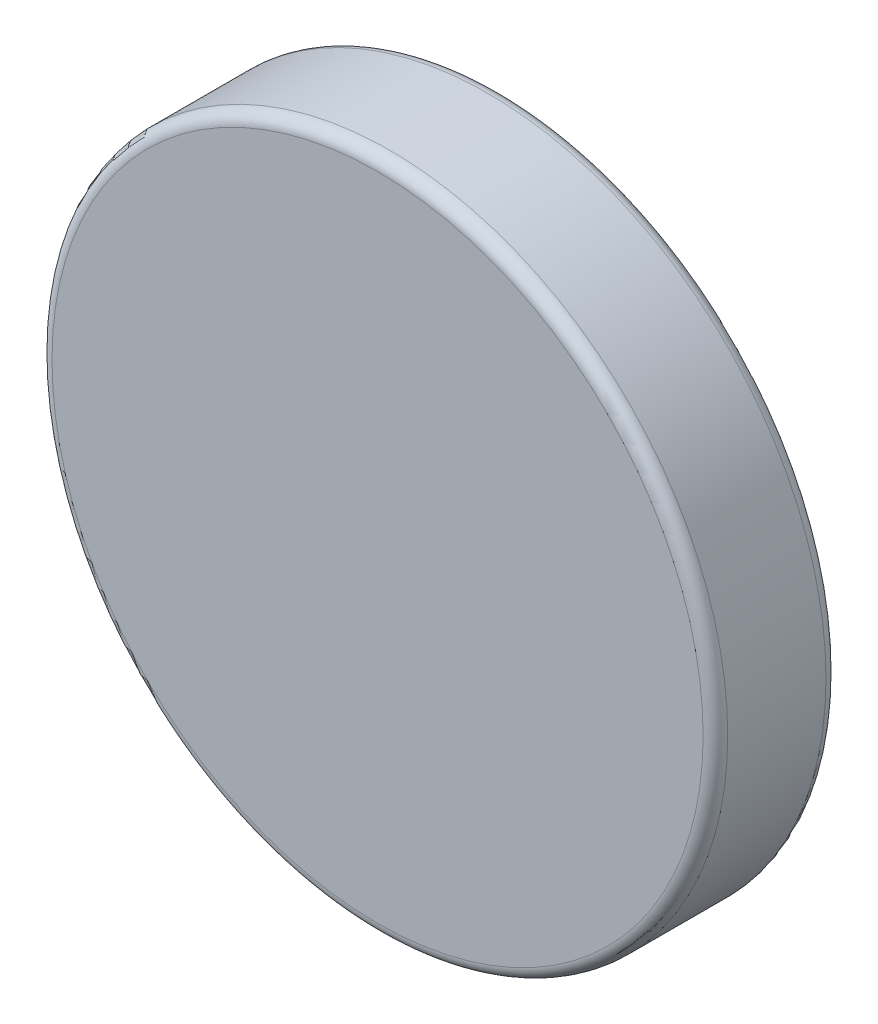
SolidWorks part; units mm, degrees
ref_plane "Ebene vorne" through (0, 0, 0) normal (0, 0, 1) x (1, 0, 0)
ref_plane "Ebene oben" through (0, 0, 0) normal (0, 1, 0) x (1, 0, 0)
ref_plane "Ebene rechts" through (0, 0, 0) normal (1, 0, 0) x (0, 0, -1)
sketch "Skizze1" plane through (0, 0, 0) normal (0, 0, 1) x (1, 0, 0)
  circle A0 centre (0, 0) radius 2.75
  dimension "D1" = 5.5
extrude "Aufsatz-Linear austragen1" add sketch "Skizze1" along normal blind 1
sketch "Skizze2" plane through (0, 0, 0) normal (0, 0, -1) x (-1, 0, 0)
  circle A0 centre (0, 0) radius 2.25
  dimension "D1" = 4.5
extrude "Schnitt-Linear austragen1" cut sketch "Skizze2" against normal blind 0.8
fillet "Verrundung1" radius 0.1 3 edges at (-2.25, 0, 0) (2.75, 0, 1) (2.75, 0, 0)
